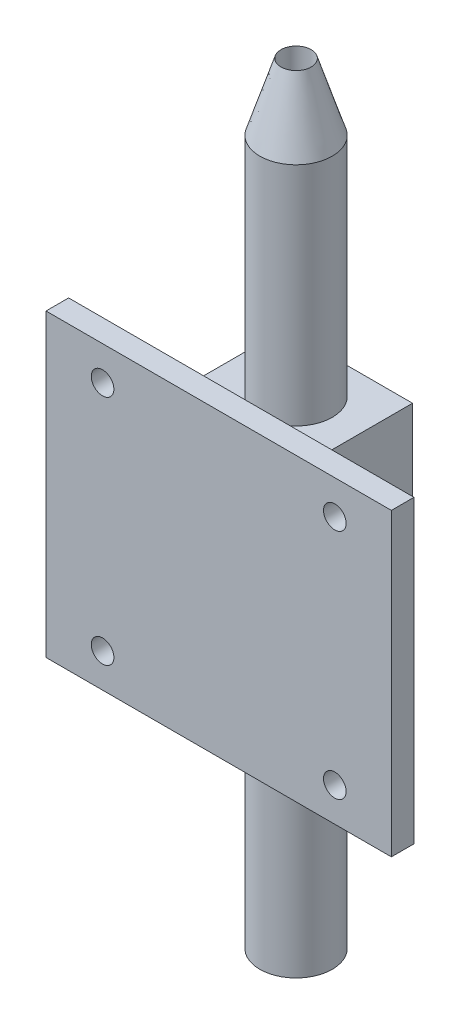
SolidWorks part; units mm, degrees
ref_plane "Front Plane" through (0, 0, 0) normal (0, 0, 1) x (1, 0, 0)
ref_plane "Top Plane" through (0, 0, 0) normal (0, 1, 0) x (1, 0, 0)
ref_plane "Right Plane" through (0, 0, 0) normal (1, 0, 0) x (0, 0, -1)
sketch "Sketch1" plane through (0, 0, 0) normal (0, 0, 1) x (1, 0, 0)
  line L0 (0, 33.8605) -> (0, -35.6856) construction
  line L2 (-22.9, 19.9) -> (-22.9, -19.9)
  line L4 (22.9, 19.9) -> (22.9, -19.9)
  line L5 (-19.9, 19.9) -> (19.9, -19.9) construction
  line L6 (-19.9, -19.9) -> (19.9, 19.9) construction
  line L7 (-22.9, 0) -> (22.9, 0) construction
  line L8 (-22.9, 19.9) -> (22.9, 19.9)
  line L9 (-22.9, -19.9) -> (22.9, -19.9)
  line L10 (-9.7218, 28.0906) -> (-9.7218, -23.9059) construction
  circle A0 centre (-15.4, 15.4) radius 1.5
  circle A1 centre (15.4, 15.4) radius 1.5
  circle A2 centre (15.4, -15.4) radius 1.5
  circle A3 centre (-15.4, -15.4) radius 1.5
  point P0 (0, 0)
  dimension "D3" = 3
  dimension "D4" = 3
  dimension "D5" = 3
  dimension "D6" = 3
  dimension "D15" = 4.5
  dimension "D17" = 4.5
  dimension "D18" = 4.5
  dimension "D2" = 7.5
  dimension "D7" = 15.4
  dimension "D8" = 15.4
  dimension "D9" = 15.4
  dimension "D10" = 15.4
  dimension "D11" = 15.4
  dimension "D12" = 15.4
  dimension "D13" = 15.4
  dimension "D14" = 15.4
  dimension "D16" = 4.5
  dimension "D19" = 7.5
  dimension "D20" = 7.5
  dimension "D21" = 7.5
  dimension "D22" = 45.8
  dimension "D23" = 45.8
extrude "Boss-Extrude1" add sketch "Sketch1" along normal blind 3
sketch "Sketch4" plane through (0, 0, 0) normal (0, 1, 0) x (1, 0, 0)
  line L0 (0, 16.0938) -> (0, -12.5484) construction
  line L2 (-8.5, 14.2098) -> (8.5, 14.2098)
  line L3 (-8.5, 14.2098) -> (-8.5, -2.7902)
  line L4 (-8.5, -2.7902) -> (8.5, -2.7902)
  line L5 (8.5, 14.2098) -> (8.5, -2.7902)
  line L6 (-8.5, 14.2098) -> (8.5, -2.7902) construction
  line L7 (-8.5, -2.7902) -> (8.5, 14.2098) construction
  point P3 (0, 5.7098)
  dimension "D1" = 17
  dimension "D2" = 17
extrude "Boss-Extrude4" add sketch "Sketch4" along normal blind 16.4 and the other way blind 16.4
sketch "Sketch5" plane through (0, 16.4, 0) normal (0, 1, 0) x (1, 0, 0)
  line L0 (0, 20.1475) -> (0, -10.857) construction
  line L1 (-17.2817, 7.2613) -> (19.6034, 7.2613) construction
  line L2 (-19.3016, 7.2613) -> (-18.1571, 7.2613)
  circle A0 centre (0, 7.2613) radius 4.8
  dimension "D1" = 9.6
extrude "Cut-Extrude5" cut sketch "Sketch5" against normal through all contours A0
sketch "Sketch8" plane through (0, 16.4, 0) normal (0, 1, 0) x (1, 0, 0)
  circle A0 centre (0, 7.2613) radius 4.8
  circle A1 centre (0, 7.2613) radius 3.75
  dimension "D1" = 7.5
extrude "Boss-Extrude9" add sketch "Sketch8" along normal blind 30 and the other way blind 63.4
sketch "Sketch10" plane through (0, 0, 0) normal (1, 0, 0) x (0, 0, -1)
  line L0 (7.2613, 46.4) -> (7.2613, 55.239)
  line L1 (12.0613, 46.4) -> (2.4613, 46.4) construction
  line L2 (7.2613, 55.239) -> (5.2613, 55.239)
  line L3 (5.2613, 55.239) -> (2.4613, 46.4)
  line L4 (2.4613, 46.4) -> (7.2613, 46.4)
  dimension "D1" = 2
  dimension "D2" = 4.8
revolve "Revolve4" add sketch "Sketch10" angle 360 about L0
sketch "Sketch11" plane through (0, 55.239, 0) normal (0, 1, 0) x (1, 0, 0)
  circle A0 centre (0, 7.2613) radius 2
extrude "Cut-Extrude6" cut sketch "Sketch11" against normal through all
